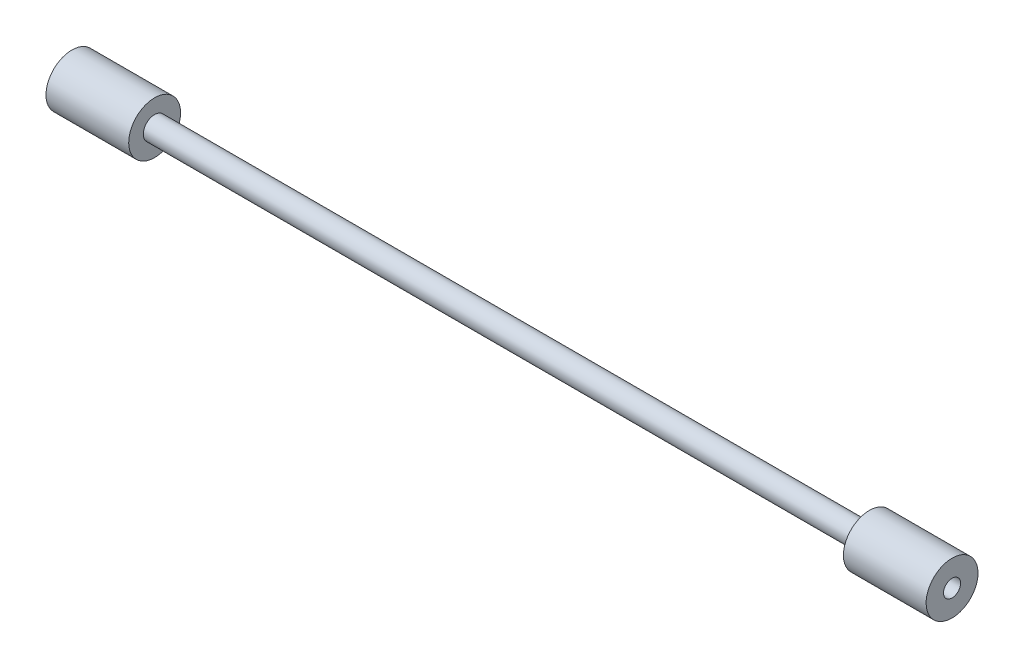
SolidWorks part; units mm, degrees
ref_plane "Front Plane" through (0, 0, 0) normal (0, 0, 1) x (1, 0, 0)
ref_plane "Top Plane" through (0, 0, 0) normal (0, 1, 0) x (1, 0, 0)
ref_plane "Right Plane" through (0, 0, 0) normal (1, 0, 0) x (0, 0, -1)
sketch "Sketch1" plane through (0, 0, 0) normal (0, 0, 1) x (1, 0, 0)
  line L0 (27.7812, 0) -> (436.7812, 0)
  line L1 (464.5625, 4.5) -> (464.5625, 13.6922)
  line L2 (464.5625, 13.6922) -> (420.9062, 13.6922)
  line L3 (420.9062, 13.6922) -> (420.9062, 6)
  line L4 (420.9062, 6) -> (43.6563, 6)
  line L5 (43.6563, 6) -> (43.6562, 13.6922)
  line L6 (43.6562, 13.6922) -> (0, 13.6922)
  line L7 (0, 13.6922) -> (0, 4.5)
  line L8 (0, 0) -> (-35.2188, 0) construction
  line L9 (464.5625, 0) -> (499.7812, 0) construction
  line L10 (0, 4.5) -> (27.7813, 4.5)
  line L11 (27.7813, 4.5) -> (27.7812, 0)
  line L12 (464.5625, 4.5) -> (436.7812, 4.5)
  line L13 (436.7812, 4.5) -> (436.7812, 0)
  dimension "D1" = 12
  dimension "D2" = 27.3844
  dimension "D3" = 27.3844
  dimension "D4" = 43.6562
  dimension "D5" = 43.6562
  dimension "D6" = 35.2188
  dimension "D7" = 535
  dimension "D8" = 9
  dimension "D9" = 27.7812
  dimension "D10" = 27.7812
  dimension "D11" = 35.2188
revolve "Revolve1" add sketch "Sketch1" angle 360 about L8
ref_plane "Plane1" through (-35.2188, 0, 0) normal (-1, 0, 0) x (0, 0, 1)
